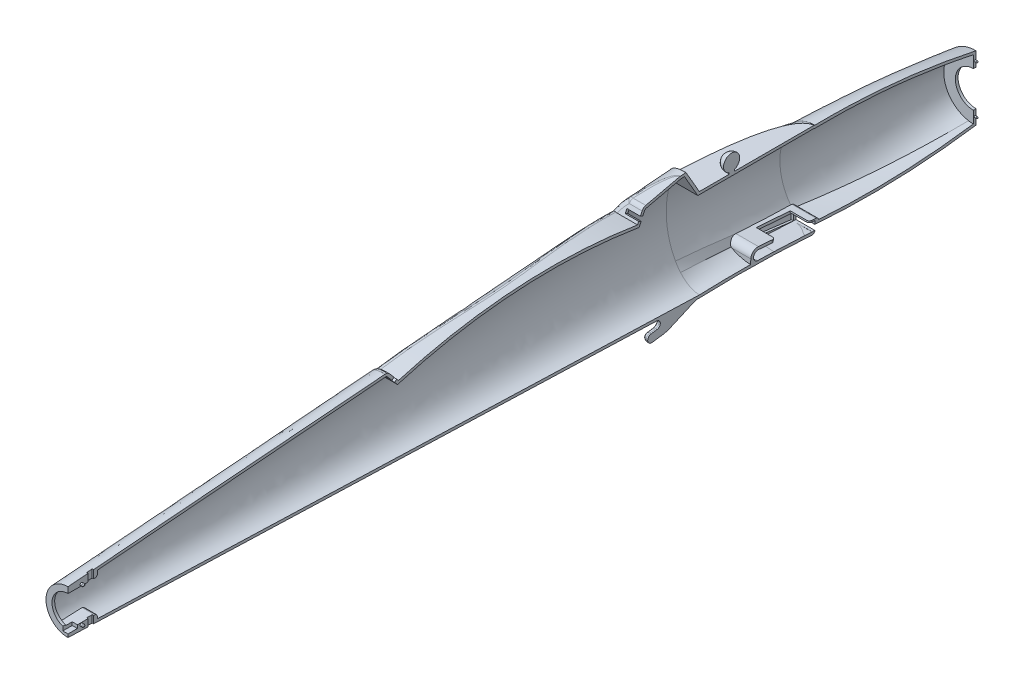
SolidWorks part; units mm, degrees
ref_plane "Plan de face" through (0, 0, 0) normal (0, 0, 1) x (1, 0, 0)
ref_plane "Plan de dessus" through (0, 0, 0) normal (0, 1, 0) x (1, 0, 0)
ref_plane "Plan de droite" through (0, 0, 0) normal (1, 0, 0) x (0, 0, -1)
mirrored part "demi fuselage droit_Rendre symétrique"
other "<demi fuselage droit>-<Congé10>"
sketch "Esquisse1" plane through (0, 0, 0) normal (1, 0, 0) x (0, 0, -1)
  circle A0 centre (-0.4, 9) radius 0.3
  circle A1 centre (-0.4, -9) radius 0.3
  circle A2 centre (-0.4, -9) radius 0.3 construction
sketch "Esquisse2" plane through (0, 0, 0) normal (1, 0, 0) x (0, 0, -1)
  circle A0 centre (-333, 6.6) radius 0.5
  circle A1 centre (-333, 6.6) radius 0.5 construction
  circle A2 centre (-333, -6.5) radius 0.5
  circle A3 centre (-333, -6.5) radius 0.5 construction
extrude "Extrusion1" add sketch "Esquisse1" along normal blind 1
extrude "Extrusion2" add sketch "Esquisse2" along normal blind 1
fillet "Congé1" radius 0.4 1 edges at (1, 6.6, 332.5)
fillet "Congé2" radius 0.4 1 edges at (1, -6.5, 332.5)
fillet "Congé3" radius 0.3 1 edges at (1, 9, 0.1)
fillet "Congé4" radius 0.3 1 edges at (1, -9, 0.1)
